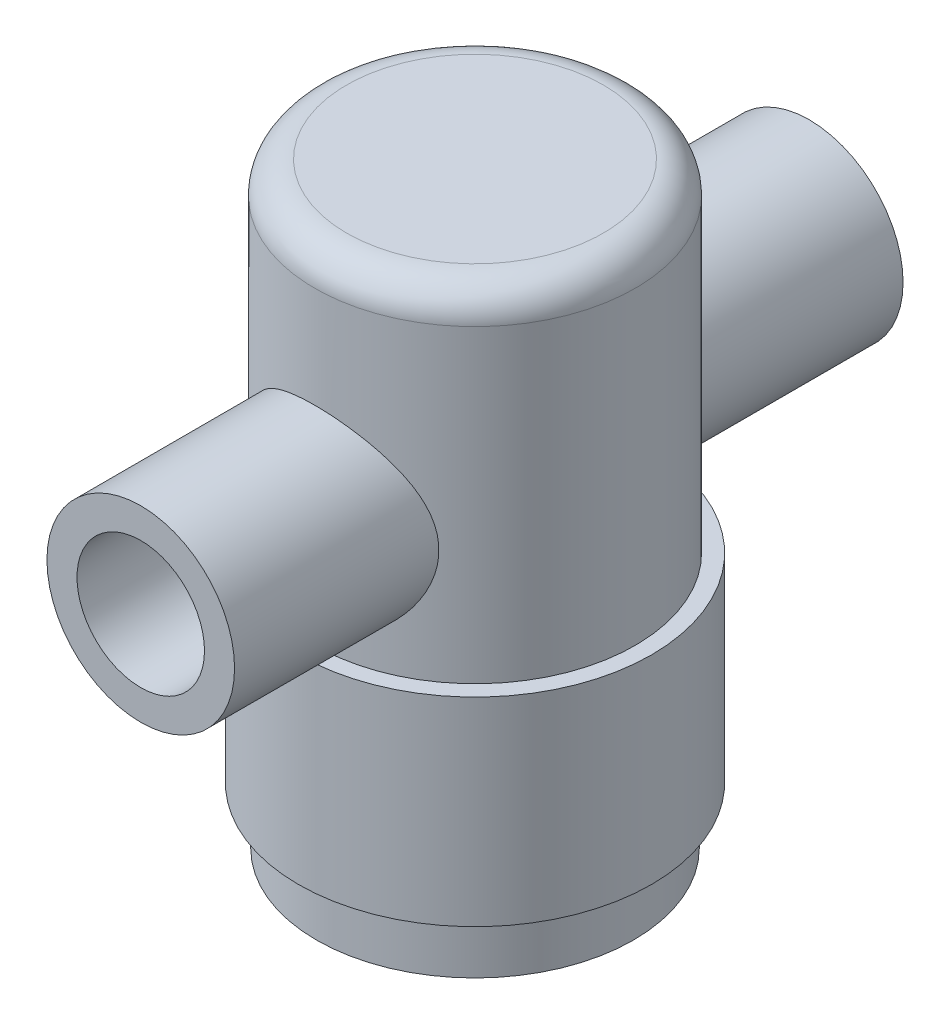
SolidWorks part; units mm, degrees
ref_plane "Front Plane" through (0, 0, 0) normal (0, 0, 1) x (1, 0, 0)
ref_plane "Top Plane" through (0, 0, 0) normal (0, 1, 0) x (1, 0, 0)
ref_plane "Right Plane" through (0, 0, 0) normal (1, 0, 0) x (0, 0, -1)
sketch "Sketch1" plane through (0, 0, 0) normal (0, 0, 1) x (1, 0, 0)
  line L0 (0, 0) -> (0, 92.1166) construction
  line L1 (-5.5626, 0) -> (-3.175, 2.3876)
  line L2 (-3.175, 2.3876) -> (-3.175, 27.6479)
  line L3 (-3.175, 27.6479) -> (0, 27.6479)
  line L4 (0, 27.6479) -> (0, 29.7434)
  line L5 (0, 29.7434) -> (-7.9819, 29.7434)
  line L7 (-7.9819, 29.7434) -> (-7.9819, 12.7508)
  line L8 (-7.9819, 12.7508) -> (-8.7948, 12.7508)
  line L9 (-8.7948, 12.7508) -> (-8.7947, 2.8448)
  line L10 (-8.7947, 2.8448) -> (-7.8994, 2.8448)
  line L11 (-7.8994, 2.8448) -> (-7.8994, 0)
  line L12 (-7.8994, 0) -> (-5.5626, 0)
  dimension "D1" = 15.7988
  dimension "D2" = 6.35
  dimension "D3" = 17.5895
  dimension "D4" = 29.7434
  dimension "D5" = 15.9639
  dimension "D6" = 45
  dimension "D7" = 2.3368
  dimension "D8" = 9.906
  dimension "D9" = 12.7508
  dimension "D10" = 27.6479
revolve "Revolve1" add sketch "Sketch1" angle 360 about L0
fillet "Fillet1" radius 1.5875 1 edges at (0, 29.7434, -7.9819)
sketch "Sketch2" plane through (0, 0, 0) normal (0, 0, 1) x (1, 0, 0)
  line L0 (0, 23.114) -> (0, 0) construction
  circle A0 centre (0, 18.4404) radius 4.6736
  dimension "D1" = 9.3472
  dimension "D2" = 23.114
extrude "Boss-Extrude1" add sketch "Sketch2" along normal mid plane 33.2994
sketch "Sketch3" plane through (0, 0, 16.6497) normal (0, 0, 1) x (1, 0, 0)
  circle A0 centre (0, 18.4404) radius 0.7937
  dimension "D1" = 1.5875
extrude "Cut-Extrude1" cut sketch "Sketch3" against normal through all
sketch "Sketch4" plane through (0, 0, 0) normal (0, -1, 0) x (1, 0, 0)
  circle A0 centre (0, 0) radius 3.175
  dimension "D1" = 6.35
extrude "Cut-Extrude2" cut sketch "Sketch4" against normal up to surface (27.6479 mm away)
sketch "Sketch5" plane through (0, 0, 16.6497) normal (0, 0, 1) x (1, 0, 0)
  circle A0 centre (0, 18.4404) radius 3.175
  dimension "D1" = 6.35
extrude "Cut-Extrude3" cut sketch "Sketch5" against normal blind 8.128
sketch "Sketch6" plane through (0, 0, -16.6497) normal (0, 0, -1) x (-1, 0, 0)
  circle A0 centre (0, 18.4404) radius 3.175
  dimension "D1" = 6.35
extrude "Cut-Extrude4" cut sketch "Sketch6" against normal blind 8.128
